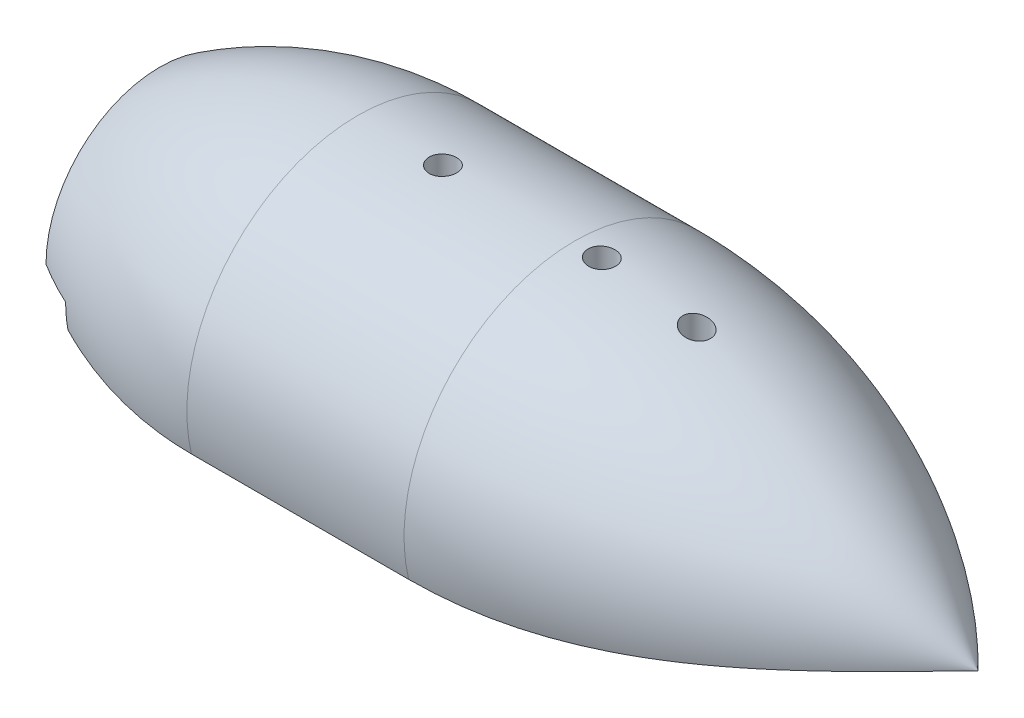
SolidWorks part; units mm, degrees
ref_plane "Front Plane" through (0, 0, 0) normal (0, 0, 1) x (1, 0, 0)
ref_plane "Top Plane" through (0, 0, 0) normal (0, 1, 0) x (1, 0, 0)
ref_plane "Right Plane" through (0, 0, 0) normal (1, 0, 0) x (0, 0, -1)
sketch "Sketch2" plane through (0, 0, 0) normal (1, 0, 0) x (0, 0, -1)
  circle A0 centre (0, 0) radius 18.288
  dimension "D1" = 36.576
extrude "Extrude1" add sketch "Sketch2" along normal blind 87.63
sketch "Sketch3" plane through (0, 0, 0) normal (0, 0, 1) x (1, 0, 0)
  line L0 (87.63, -18.288) -> (87.63, 18.288) construction
  line L2 (44.45, 0) -> (44.45, 18.288) construction
  line L3 (87.63, 18.288) -> (0, 18.288) construction
  line L4 (87.63, 0.0088) -> (87.63, 18.288)
  line L5 (87.63, 18.288) -> (44.45, 18.288)
  line L6 (0, 0) -> (21.1849, 0) construction
  line L7 (21.1849, 0) -> (21.1849, 18.288) construction
  line L8 (0, 0) -> (0, 12.192) construction
  line L9 (0, 18.288) -> (0, -18.288) construction
  line L10 (21.1849, 18.288) -> (0, 18.288)
  line L11 (0, 18.288) -> (0, 12.192)
  arc A0 (44.45, 18.288) -> (87.63, 0.0088) centre (44.45, -41.8525) cw
  arc A1 (21.1849, 18.288) -> (0, 12.192) centre (21.1849, -21.5709) ccw
  dimension "D1" = 12.192
revolve "shape" cut sketch "Sketch3" angle 360 about L6
sketch "Sketch5" plane through (0, 0, 0) normal (-1, 0, 0) x (0, 0, 1)
  circle A0 centre (0, 0) radius 7.9375
  dimension "D1" = 15.875
extrude "Cut-Extrude2" cut sketch "Sketch5" against normal blind 24.13
sketch "Sketch4" plane through (0, 0, 0) normal (-1, 0, 0) x (0, 0, 1)
  line L0 (0, -20.6375) -> (0, 0) construction
  line L1 (16.3949, -8.103) -> (-16.3949, -8.103)
  line L2 (0, -20.6375) -> (16.3949, -8.103) construction
  line L3 (16.3949, -8.103) -> (16.3949, -20.6375)
  line L4 (16.3949, -20.6375) -> (-16.3949, -20.6375)
  line L5 (-16.3949, -20.6375) -> (-16.3949, -8.103)
  circle A1 centre (0, 0) radius 18.288 construction
  dimension "D1" = 20.6375
  dimension "D2" = 20.6375
extrude "Cut-Extrude1" cut sketch "Sketch4" against normal through all
sketch "Sketch8" plane through (0, 0, 0) normal (0, 1, 0) x (1, 0, 0)
  line L0 (26.2128, 3.2946) -> (26.2128, 11.8036)
  line L1 (26.2128, 3.2946) -> (34.4678, 3.2946)
  line L2 (18.923, 11.8036) -> (26.2128, 11.8036)
  line L3 (26.2128, -3.3094) -> (34.4678, -3.3094)
  line L4 (18.923, 11.8036) -> (18.923, -11.8184)
  line L5 (18.923, -11.8184) -> (26.2128, -11.8184)
  line L6 (26.2128, -11.8184) -> (26.2128, -3.3094)
  line L7 (34.4678, 11.8036) -> (42.3418, 11.8036)
  line L8 (34.4678, -11.8184) -> (34.4678, -3.3094)
  line L9 (34.4678, -11.8184) -> (42.3418, -11.8184)
  line L10 (42.3418, 11.8036) -> (42.3418, -11.8184)
  line L11 (34.4678, 3.2946) -> (34.4678, 11.8036)
  line L12 (42.3418, -0.0074) -> (18.923, -0.0074) construction
  line L13 (0, 0) -> (92.1788, -0.0362) construction
  line L14 (0, 12.192) -> (0, -12.192) construction
  line L15 (26.2128, 3.2946) -> (26.2128, -3.3094) construction
  point P20 (26.2128, -0.0074)
  dimension "D1" = 7.2898
  dimension "D2" = 7.874
  dimension "D3" = 8.255
  dimension "D4" = 18.923
  dimension "D5" = 23.622
  dimension "D6" = 6.604
extrude "camera base and transmitter" cut sketch "Sketch8" along normal blind 12.954 and the other way through all
fillet "Fillet1" radius 1.5875 8 edges at (42.3418, 2.4255, -11.8036) (34.4678, 2.4255, -11.8036) (26.2128, 2.4255, -11.8036) (18.923, 2.4255, -11.8036) (42.3418, 2.4255, 11.8184) (34.4678, 2.4255, 11.8184) (26.2128, 2.4255, 11.8184) (18.923, 2.4255, 11.8184)
sketch "r" plane through (0, 0, 0) normal (0, 1, 0) x (1, 0, 0)
  line L1 (65.7098, -0.0074) -> (42.3418, -0.0074) construction
  line L2 (42.3418, 3.1676) -> (42.3418, -3.1824)
  line L3 (42.3418, -3.1824) -> (65.7098, -3.1824)
  line L4 (65.7098, 3.1676) -> (65.7098, -3.1824)
  line L5 (42.3418, 3.1676) -> (65.7098, 3.1676)
  line L6 (42.3418, -10.2309) -> (42.3418, 10.2161) construction
  line L7 (42.3418, -10.2309) -> (42.3418, 10.2161) construction
  dimension "D1" = 6.35
  dimension "D2" = 23.368
extrude "tab slot" cut sketch "r" along normal blind 10.16 and the other way through all
sketch "Sketch9" plane through (18.923, 0, 0) normal (1, 0, 0) x (0, 0, -1)
  line L1 (-7.874, 7.874) -> (7.874, 7.874)
  line L2 (-7.874, 7.874) -> (-7.874, -2.6762)
  line L3 (-7.874, -2.6762) -> (7.874, -2.6762)
  line L4 (7.874, 7.874) -> (7.874, -2.6762)
extrude "Cut-Extrude6" cut sketch "Sketch9" against normal blind 5.588
sketch "Sketch10" plane through (0, 0, 0) normal (0, 1, 0) x (1, 0, 0)
  line L0 (0, 12.192) -> (0, -12.192) construction
  line L1 (0, -12.7042) -> (10.9133, -12.7042)
  line L2 (0, -12.7042) -> (0, 12.8228)
  line L3 (0, 12.8228) -> (10.9133, 12.8228)
  line L4 (10.9133, -12.7042) -> (10.9133, -7.874)
  line L5 (15.1084, 0.0593) -> (0, 0.0593) construction
  line L6 (18.923, 10.2161) -> (18.923, -10.2309) construction
  line L7 (10.9133, -7.874) -> (18.923, -7.874)
  line L8 (18.923, -7.874) -> (18.923, 7.874)
  line L9 (18.923, 7.874) -> (10.9133, 7.874)
  line L11 (10.9133, 7.874) -> (10.9133, 12.8228)
  line L12 (10.9133, -7.874) -> (10.9133, 7.874) construction
  dimension "D1" = 25.527
extrude "holder interface" cut sketch "Sketch10" against normal through all
sketch "Sketch11" plane through (0, 0, 0) normal (0, 0, 1) x (1, 0, 0)
  line L0 (0, 12.192) -> (0, 0) construction
  line L1 (0, -7.3177) -> (4.572, -7.3177)
  line L2 (0, -7.3177) -> (0, 0)
  line L3 (0, 0) -> (4.572, 0)
  line L4 (4.572, -7.3177) -> (4.572, 0)
  line L5 (0.8391, 0) -> (10.9133, 0) construction
  point P6 (0.8391, 0)
  point P7 (5.491, -8.103)
  dimension "D1" = 4.572
extrude "Cut-Extrude8" cut sketch "Sketch11" against normal through all and the other way through all
fillet "Fillet2" radius 3.175 2 edges at (13.335, 4.438, 7.874) (13.335, 4.438, -7.874)
fillet "Fillet3" radius 3.175 2 edges at (65.7098, 1.0285, 3.1824) (65.7098, 1.0285, -3.1676)
sketch "Sketch13" plane through (0, 12.954, 0) normal (0, -1, 0) x (1, 0, 0)
  line L3 (26.2128, 3.3094) -> (26.2128, -3.2946) construction
  line L4 (34.4678, 3.3094) -> (34.4678, -3.2946) construction
  line L5 (34.4678, 0.0074) -> (26.2128, 0.0074) construction
sketch "Sketch14" plane through (0, 10.16, 0) normal (0, -1, 0) x (1, 0, 0)
  line L0 (65.7098, 0.0074) -> (34.4678, 0.0074) construction
  line L1 (34.4678, -10.2161) -> (34.4678, -3.2946) construction
  line L2 (34.4678, 3.3094) -> (34.4678, -3.2946) construction
hole_wizard "#4 Clearance Hole1" positions "3DSketch1" profile "Sketch12" hole size "#4" standard "Ansi Inch"
sketch3d "3DSketch1"
  line L1 (65.7098, 10.16, 0.0074) -> (34.4678, 10.16, 0.0074) construction
  line L2 (34.4678, 12.954, 0.0074) -> (26.2128, 12.954, 0.0074) construction
  point P0 (30.3403, 12.954, 0.0074)
  point P2 (47.3583, 10.16, 0.0074)
  point P4 (57.5183, 10.16, 0.0074)
  dimension "D1" = 10.16
  dimension "D2" = 12.8905
sketch "Sketch12" plane through (30.3403, 12.954, 0.0074) normal (1, 0, 0) x (0, 0, -1)
  line L0 (0, 0) -> (0, 5.334)
  line L1 (0, 5.334) -> (1.4732, 5.334)
  line L2 (1.4732, 5.334) -> (1.4732, 0)
  line L5 (1.4732, 0) -> (0, 0)
  line L11 (0, -6.35) -> (0, 107.95) construction
  dimension "Thru Hole Dia." = 2.9464
  dimension "Thru Hole Depth" = 5.334
fillet "Fillet4" radius 2.54 2 edges at (10.9133, -4.0515, -12.8228) (10.9133, -4.0515, 12.7042)
sketch "Sketch15" plane through (0, -8.103, 0) normal (0, -1, 0) x (1, 0, 0)
  circle A0 centre (38.792, 0.0074) radius 4.7625
  dimension "D1" = 9.525
extrude "Cut-Extrude9" cut sketch "Sketch15" against normal offset from surface (22.835 mm away) 1.778
sketch "Sketch16" plane through (0, 0, 0) normal (-1, 0, 0) x (0, 0, 1)
  circle A0 centre (0, -39.6875) radius 39.6875
  dimension "D1" = 79.375
extrude "Cut-Extrude10" cut sketch "Sketch16" against normal through all
